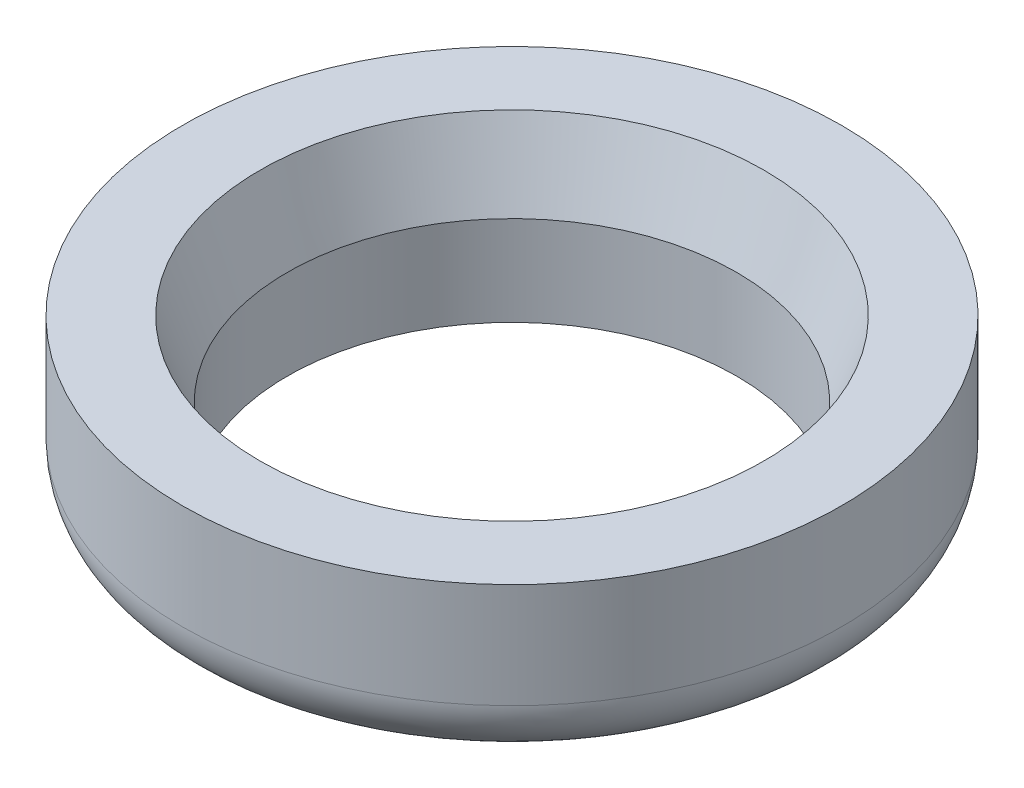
SolidWorks part; units mm, degrees
ref_plane "Face" through (0, 0, 0) normal (0, 0, 1) x (1, 0, 0)
ref_plane "Dessus" through (0, 0, 0) normal (0, 1, 0) x (1, 0, 0)
ref_plane "Profil" through (0, 0, 0) normal (1, 0, 0) x (0, 0, -1)
sketch "Esquisse1" plane through (0, 0, 0) normal (0, 1, 0) x (1, 0, 0)
  circle A0 centre (0, 0) radius 11
  dimension "D1" = 22
extrude "Base-Extrusion" add sketch "Esquisse1" along normal blind 5.5
sketch "Esquisse2" plane through (0, 5.5, 0) normal (0, 1, 0) x (1, 0, 0)
  circle A0 centre (0, 0) radius 7.5
  circle A1 centre (0, 0) radius 11 construction
  dimension "D1" = 15
extrude "Enlèv. mat.-Extru.1" cut sketch "Esquisse2" against normal through all
fillet "Congé1" radius 2
chamfer "Chanfrein1" distance 2.5 angle 20
sketch "Esquisse3" plane through (0, 5.5, 0) normal (0, 1, 0) x (-1, 0, 0)
  line L0 (0, 0) -> (19.5383, 0)
  line L1 (0, 0) -> (-13.8157, 13.8157)
  arc A0 (19.5383, 0) -> (-13.8157, 13.8157) centre (0, 0) ccw
  dimension "D1" = 135
extrude "Coupe" cut sketch "Esquisse3" against normal through all
